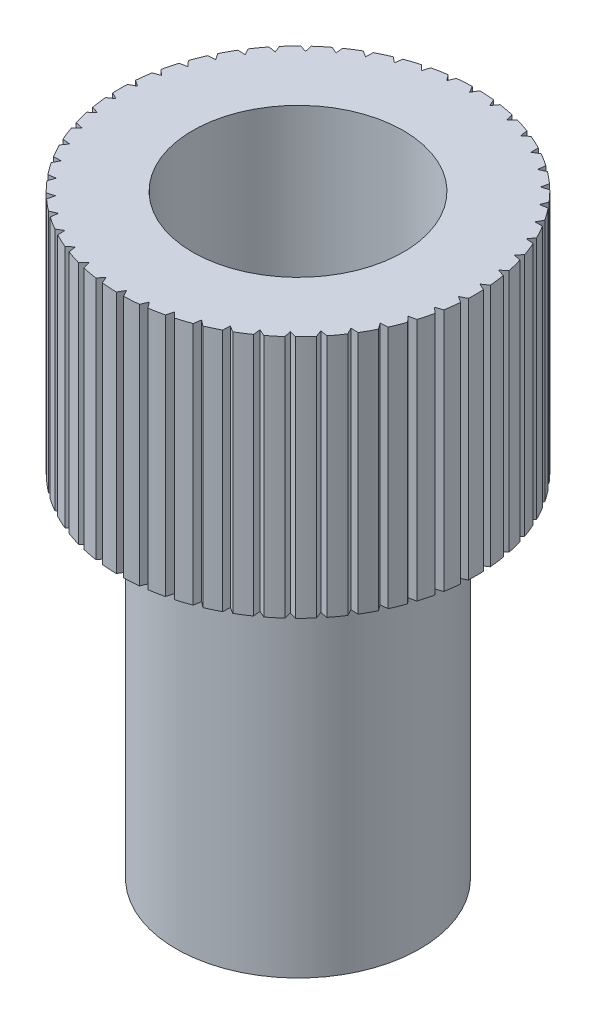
SolidWorks part; units mm, degrees
ref_plane "Front" through (0, 0, 0) normal (0, 0, 1) x (1, 0, 0)
ref_plane "Top" through (0, 0, 0) normal (0, 1, 0) x (1, 0, 0)
ref_plane "Right" through (0, 0, 0) normal (1, 0, 0) x (0, 0, -1)
sketch "Sketch1" plane through (0, 0, 0) normal (0, 0, 1) x (1, 0, 0)
  line L0 (0, 0) -> (0, 17.0009) construction
  line L1 (1.651, 0) -> (1.651, 10.6525)
  line L2 (1.651, 10.6525) -> (2.7432, 10.6525)
  line L3 (2.7432, 10.6525) -> (2.7432, 15.494)
  line L4 (2.7432, 15.494) -> (4.6355, 15.494)
  line L5 (4.6355, 15.494) -> (4.6355, 9.144)
  line L6 (4.6355, 9.144) -> (3.175, 9.144)
  line L7 (3.175, 9.144) -> (3.175, 0)
  line L8 (3.175, 0) -> (1.651, 0)
  dimension "D1" = 3.302
  dimension "D2" = 6.35
  dimension "D3" = 5.4864
  dimension "D4" = 9.271
  dimension "D5" = 6.35
  dimension "D6" = 15.494
revolve "Revolve1" add sketch "Sketch1" angle 360 about L0
sketch "Sketch2" plane through (0, 15.494, 0) normal (0, 1, 0) x (-1, 0, 0)
  line L0 (0, 4.4674) -> (-0.2586, 4.9153)
  line L1 (0, 4.4674) -> (0.2586, 4.9153)
  line L2 (0.2586, 4.9153) -> (-0.2586, 4.9153)
  dimension "D1" = 60
  dimension "D2" = 60
extrude "Cut-Extrude1" cut sketch "Sketch2" against normal through all
pattern_circular "CirPattern1" count 50 over 360 about axis through (0, 0, 0) along (0, 1, 0)
